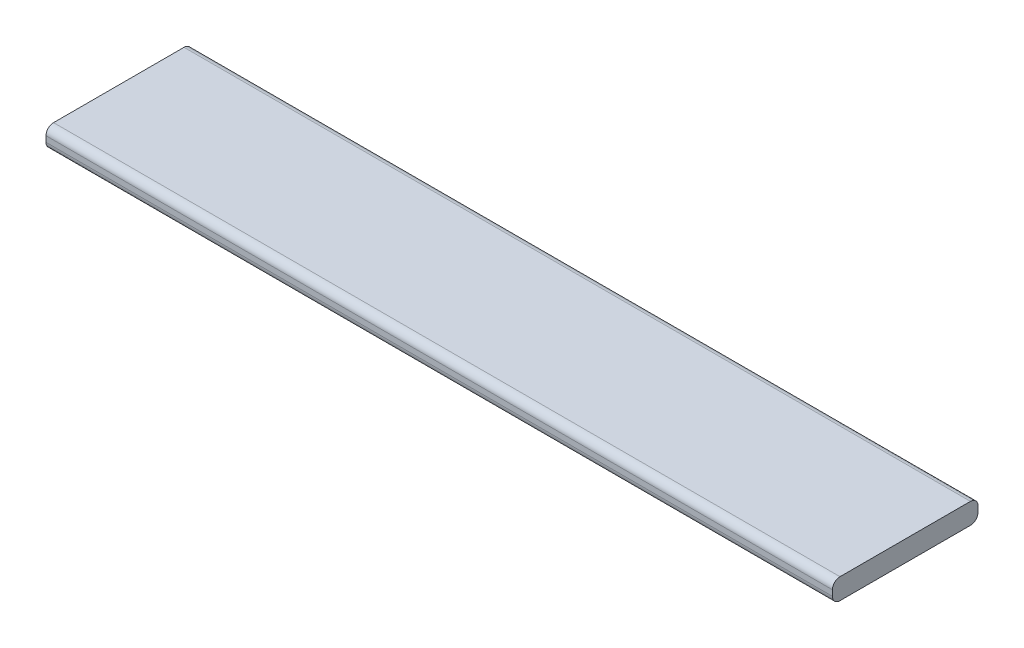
SolidWorks part; units mm, degrees
ref_plane "Bottom Plane" through (0, 0, 0) normal (0, 0, 1) x (1, 0, 0)
ref_plane "Front Plane" through (0, 0, 0) normal (0, 1, 0) x (1, 0, 0)
ref_plane "Left Plane" through (0, 0, 0) normal (1, 0, 0) x (0, 0, -1)
ref_plane "Right Plane" through (660.4, 0, 0) normal (1, 0, 0) x (0, 0, -1)
ref_plane "Back Plane" through (0, 19.05, 0) normal (0, 1, 0) x (1, 0, 0)
ref_plane "Top Plane" through (0, 0, 139.7) normal (0, 0, 1) x (1, 0, 0)
sketch "Sketch2" plane through (0, 0, 0) normal (1, 0, 0) x (0, 0, -1)
  line L1 (0, 0) -> (-122.2375, 0)
  line L2 (0, 0) -> (0, 17.4625)
  line L3 (0, 17.4625) -> (-122.2375, 17.4625)
  line L4 (-122.2375, 0) -> (-122.2375, 17.4625)
  dimension "D1" = 17.4625
  dimension "D2" = 122.2375
extrude "Boss-Extrude1" add sketch "Sketch2" along normal up to surface (660.4 mm away)
ref_plane "half length" through (330.2, 0, 0) normal (1, 0, 0) x (0, 0, -1)
ref_plane "Half Width" through (0, 0, 69.85) normal (0, 0, 1) x (1, 0, 0)
fillet "Fillet1" radius 6.35 4 edges at (330.2, 17.4625, 122.2375) (330.2, 17.4625, 0) (330.2, 0, 0) (330.2, 0, 122.2375)
